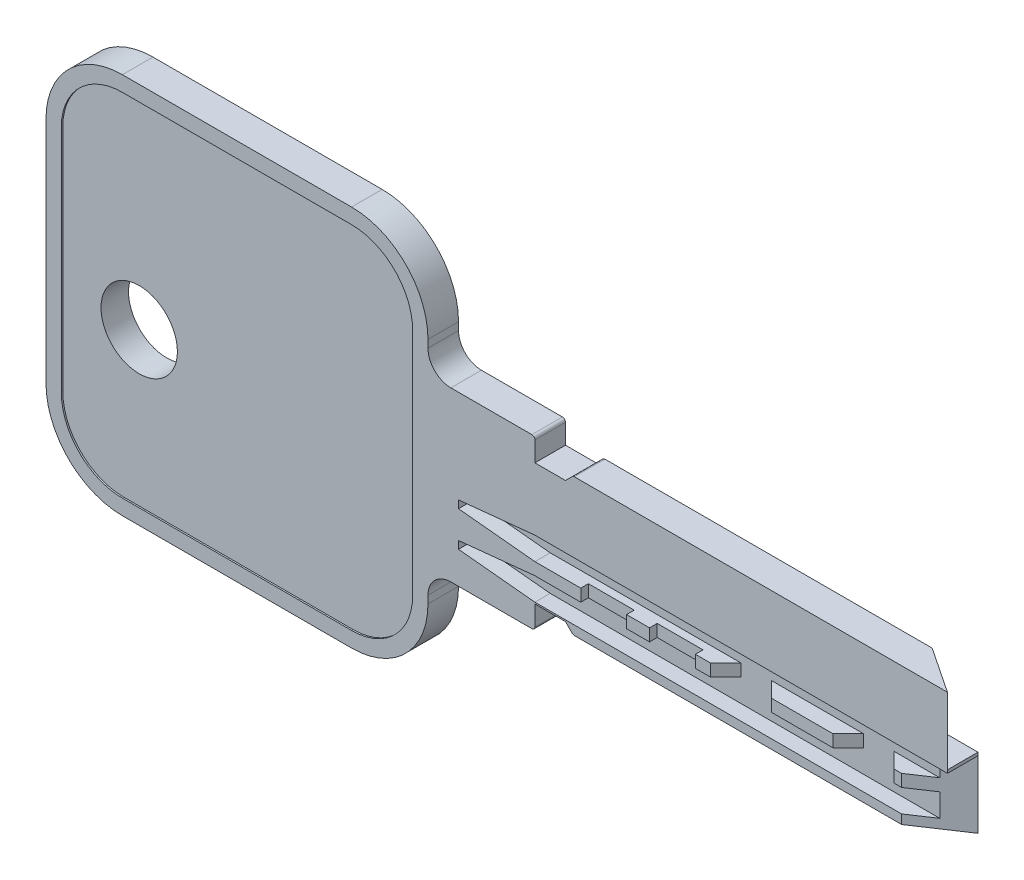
SolidWorks part; units mm, degrees
ref_plane "Front Plane" through (0, 0, 0) normal (0, 0, 1) x (1, 0, 0)
ref_plane "Top Plane" through (0, 0, 0) normal (0, 1, 0) x (1, 0, 0)
ref_plane "Right Plane" through (0, 0, 0) normal (1, 0, 0) x (0, 0, -1)
sketch "Sketch1" plane through (0, 0, 0) normal (0, 0, 1) x (1, 0, 0)
  line L1 (-7.5, 12.5) -> (7.5, 12.5)
  line L2 (-12.5, 7.5) -> (-12.5, -7.5)
  line L3 (-7.5, -12.5) -> (7.5, -12.5)
  line L4 (12.5, 7.5) -> (12.5, -7.5) construction
  line L5 (-12.5, 12.5) -> (12.5, -12.5) construction
  line L6 (-12.5, -12.5) -> (12.5, 12.5) construction
  line L7 (12.5, 0) -> (46.5, 0) construction
  line L8 (12.5, 7.5) -> (12.5, 7)
  line L9 (14, 5.5) -> (46.5, 5.5)
  line L10 (12.5, 5.5) -> (12.5, -5.5) construction
  line L11 (14, -5.5) -> (46.5, -5.5)
  line L12 (46.5, 5.5) -> (46.5, -5.5)
  line L13 (12.5, -7.5) -> (12.5, -7)
  arc A0 (7.5, -12.5) -> (12.5, -7.5) centre (7.5, -7.5) ccw
  arc A1 (-12.5, -7.5) -> (-7.5, -12.5) centre (-7.5, -7.5) ccw
  arc A2 (7.5, 12.5) -> (12.5, 7.5) centre (7.5, 7.5) cw
  arc A3 (-7.5, 12.5) -> (-12.5, 7.5) centre (-7.5, 7.5) ccw
  circle A4 centre (-6.5, -1.5) radius 2.5
  arc A5 (12.5, -7) -> (14, -5.5) centre (14, -7) cw
  arc A6 (14, 5.5) -> (12.5, 7) centre (14, 7) cw
  point P0 (0, 0)
  dimension "D2" = 5
  dimension "D4" = 5
  dimension "D7" = 1.5
  dimension "D1" = 25
  dimension "D3" = 6
  dimension "D5" = 11
  dimension "D6" = 34
  dimension "D8" = 11
extrude "Boss-Extrude1" add sketch "Sketch1" along normal mid plane 2
sketch "Sketch2" plane through (0, 0, 1) normal (0, 0, 1) x (1, 0, 0)
  line L0 (12.5, 7) -> (12.5, 7.5) construction
  line L1 (7.5, 12.5) -> (-7.5, 12.5) construction
  line L2 (-12.5, 7.5) -> (-12.5, -7.5) construction
  line L3 (-7.5, -12.5) -> (7.5, -12.5) construction
  line L4 (12.5, -7.5) -> (12.5, -7) construction
  line L5 (12.5, 7) -> (12.5, 7.5) construction
  line L6 (7.5, 12.5) -> (-7.5, 12.5) construction
  line L7 (-12.5, 7.5) -> (-12.5, -7.5) construction
  line L8 (-7.5, -12.5) -> (7.5, -12.5) construction
  line L9 (12.5, -7.5) -> (12.5, -7) construction
  line L10 (12.5, 7) -> (12.5, -7) construction
  line L11 (11.5, 7) -> (11.5, 7.5)
  line L12 (7.5, 11.5) -> (-7.5, 11.5)
  line L13 (-11.5, 7.5) -> (-11.5, -7.5)
  line L14 (-7.5, -11.5) -> (7.5, -11.5)
  line L15 (11.5, -7.5) -> (11.5, -7)
  line L16 (11.5, 7) -> (11.5, -7)
  arc A0 (12.5, 7.5) -> (7.5, 12.5) centre (7.5, 7.5) ccw construction
  arc A1 (-7.5, 12.5) -> (-12.5, 7.5) centre (-7.5, 7.5) ccw construction
  arc A2 (-12.5, -7.5) -> (-7.5, -12.5) centre (-7.5, -7.5) ccw construction
  arc A3 (7.5, -12.5) -> (12.5, -7.5) centre (7.5, -7.5) ccw construction
  arc A4 (12.5, 7.5) -> (7.5, 12.5) centre (7.5, 7.5) ccw construction
  arc A5 (-7.5, 12.5) -> (-12.5, 7.5) centre (-7.5, 7.5) ccw construction
  arc A6 (-12.5, -7.5) -> (-7.5, -12.5) centre (-7.5, -7.5) ccw construction
  arc A7 (7.5, -12.5) -> (12.5, -7.5) centre (7.5, -7.5) ccw construction
  arc A8 (11.5, 7.5) -> (7.5, 11.5) centre (7.5, 7.5) ccw
  arc A9 (-7.5, 11.5) -> (-11.5, 7.5) centre (-7.5, 7.5) ccw
  arc A10 (-11.5, -7.5) -> (-7.5, -11.5) centre (-7.5, -7.5) ccw
  arc A11 (7.5, -11.5) -> (11.5, -7.5) centre (7.5, -7.5) ccw
  dimension "D1" = 1
extrude "Cut-Extrude2" cut sketch "Sketch2" against normal blind 0.1
mirror "Mirror1" about plane through (0, 0, 0) normal (0, 0, 1) of "Cut-Extrude2"
sketch "Sketch3" plane through (0, 0, 1) normal (0, 0, 1) x (1, 0, 0)
  line L0 (19.5, 5.5) -> (19.5, 4)
  line L1 (46.5, 5.5) -> (14, 5.5) construction
  line L2 (19.5, 4) -> (21.5, 4)
  line L3 (21.5, 4) -> (22, 4.5)
  line L4 (22, 4.5) -> (46.5, 4.5)
  line L5 (46.5, -5.5) -> (46.5, 5.5) construction
  line L6 (46.5, 4.5) -> (46.5, 5.5)
  line L7 (46.5, 5.5) -> (19.5, 5.5)
  line L8 (12.5, 7) -> (12.5, 7.5) construction
  dimension "D1" = 1.5
  dimension "D2" = 7
  dimension "D3" = 1
  dimension "D4" = 2
  dimension "D5" = 2.5
extrude "Cut-Extrude3" cut sketch "Sketch3" along direction (0, 0, 1) on the side against the normal up to next (2 mm away)
fillet "Fillet1" radius 0.2 2 edges at (22, 4.5, 0) (19.5, 5.5, 0)
mirror "Mirror2" about plane through (0, 0, 0) normal (0, 1, 0) of "Cut-Extrude3", "Fillet1"
sketch "Sketch4" plane through (0, 0, 1) normal (0, 0, 1) x (1, 0, 0)
  line L0 (46.5, -0.1) -> (19.5, -0.1)
  line L1 (46.5, -4.5) -> (46.5, 4.5) construction
  line L2 (19.5, -0.1) -> (14.5, -0.6)
  line L3 (14.5, -0.6) -> (14.5, -1.1)
  line L4 (14.5, -1.1) -> (19.5, -1.6)
  line L5 (19.5, -1.6) -> (46.5, -1.6)
  line L6 (46.5, -1.6) -> (46.5, -0.1)
  line L7 (14.5, -0.85) -> (46.5, -0.85) construction
  line L9 (22.0828, -4.5) -> (46.5, -4.5) construction
  dimension "D1" = 5
  dimension "D2" = 1.5
  dimension "D3" = 0.5
  dimension "D4" = 32
  dimension "D5" = 2.9
extrude "Cut-Extrude4" cut sketch "Sketch4" against normal blind 1
pattern_linear "LPattern1" count 2 spacing 2.3 along (0, -1, 0) of "Cut-Extrude4"
sketch "Sketch5" plane through (0, 0, 1) normal (0, 0, 1) x (1, 0, 0)
  line L0 (19.5, -1.6) -> (46.5, -1.6) construction
  line L1 (22.5, -1.6) -> (25.5, -1.6)
  line L2 (22.5, -1.6) -> (22.5, -2.4)
  line L3 (22.5, -2.4) -> (25.5, -2.4)
  line L4 (25.5, -1.6) -> (25.5, -2.4)
  line L5 (46.5, -2.4) -> (19.5, -2.4) construction
  line L6 (19.5, -1.6) -> (46.5, -1.6) construction
  line L7 (27, -1.6) -> (30, -1.6)
  line L8 (27, -1.6) -> (27, -2.4)
  line L9 (27, -2.4) -> (30, -2.4)
  line L10 (30, -1.6) -> (30, -2.4)
  line L11 (46.5, -2.4) -> (19.5, -2.4) construction
  line L12 (12.5, 7) -> (12.5, 7.5) construction
  dimension "D1" = 3
  dimension "D2" = 1.5
  dimension "D3" = 10
extrude "Cut-Extrude5" cut sketch "Sketch5" against normal blind 0.5
sketch "Sketch6" plane through (0, -2.4, 0) normal (0, -1, 0) x (1, 0, 0)
  line L0 (31, 1) -> (32, 0)
  line L1 (22.0828, 1) -> (46.5, 1) construction
  line L2 (32, 0) -> (34, 0)
  line L3 (34, 0) -> (35, 1)
  line L4 (35, 1) -> (31, 1)
  line L5 (39, 1) -> (40, 0)
  line L6 (40, 0) -> (42, 0)
  line L7 (42, 0) -> (43, 1)
  line L8 (43, 1) -> (39, 1)
  line L9 (33, 0) -> (33, 1) construction
  line L10 (41, 0) -> (41, 1) construction
  line L11 (46.5, -1) -> (46.5, 1) construction
  dimension "D1" = 4
  dimension "D2" = 2
  dimension "D3" = 4
  dimension "D4" = 3.5
extrude "Cut-Extrude6" cut sketch "Sketch6" against normal up to surface (0.8 mm away) contours L3 L0 M15 M17 | L7 L5 M15 M17
sketch "Sketch7" plane through (0, -4.5, 0) normal (0, -1, 0) x (1, 0, 0)
  line L0 (46.5, -1) -> (43.5, 1)
  line L1 (22.0828, 1) -> (46.5, 1) construction
  line L2 (43.5, 1) -> (46.5, 1)
  line L3 (46.5, 1) -> (46.5, -1)
  dimension "D1" = 3
extrude "Cut-Extrude7" cut sketch "Sketch7" against normal up to surface (4.4 mm away)
sketch "Sketch8" plane through (0, 0, -1) normal (0, 0, -1) x (-1, 0, 0)
  line L0 (-46.5, 0.1) -> (-19.5, 0.1)
  line L1 (-46.5, -4.5) -> (-46.5, -0.1) construction
  line L2 (-19.5, 0.1) -> (-14.5, 0.6)
  line L3 (-14.5, 0.6) -> (-14.5, 1.1)
  line L4 (-14.5, 1.1) -> (-19.5, 1.6)
  line L5 (-19.5, 1.6) -> (-46.5, 1.6)
  line L6 (-46.5, -0.1) -> (-46.5, 4.5) construction
  line L7 (-46.5, 1.6) -> (-46.5, 0.1)
  line L8 (-46.5, 0.85) -> (-14.5, 0.85) construction
  line L9 (-46.5, 4.5) -> (-22.0828, 4.5) construction
  dimension "D1" = 32
  dimension "D2" = 0.5
  dimension "D3" = 1.5
  dimension "D4" = 5
  dimension "D5" = 2.9
extrude "Cut-Extrude8" cut sketch "Sketch8" against normal blind 1
pattern_linear "LPattern2" count 2 spacing 2.3 along (0, 1, 0) of "Cut-Extrude8"
sketch "Sketch9" plane through (0, 0, -1) normal (0, 0, -1) x (-1, 0, 0)
  line L0 (-46.5, 2.4) -> (-19.5, 2.4) construction
  line L1 (-21.5, 2.4) -> (-24.5, 2.4)
  line L2 (-21.5, 2.4) -> (-21.5, 1.6)
  line L3 (-21.5, 1.6) -> (-24.5, 1.6)
  line L4 (-24.5, 2.4) -> (-24.5, 1.6)
  line L5 (-19.5, 1.6) -> (-46.5, 1.6) construction
  line L6 (-46.5, 2.4) -> (-19.5, 2.4) construction
  line L7 (-26, 2.4) -> (-29, 2.4)
  line L8 (-26, 2.4) -> (-26, 1.6)
  line L9 (-26, 1.6) -> (-29, 1.6)
  line L10 (-29, 2.4) -> (-29, 1.6)
  line L11 (-19.5, 1.6) -> (-46.5, 1.6) construction
  line L12 (-11.5, -7.5) -> (-11.5, 7.5) construction
  dimension "D1" = 3
  dimension "D2" = 10
  dimension "D3" = 1.5
extrude "Cut-Extrude9" cut sketch "Sketch9" against normal blind 0.5
sketch "Sketch10" plane through (0, 2.4, 0) normal (0, 1, 0) x (1, 0, 0)
  line L0 (31, 1) -> (32, 0)
  line L1 (46.5, 1) -> (22.0828, 1) construction
  line L2 (32, 0) -> (34, 0)
  line L3 (34, 0) -> (35, 1)
  line L4 (35, 1) -> (31, 1)
  line L5 (39, 1) -> (40, 0)
  line L6 (40, 0) -> (42, 0)
  line L7 (42, 0) -> (43, 1)
  line L8 (43, 1) -> (39, 1)
  line L9 (33, 0) -> (33, 1) construction
  line L10 (41, 0) -> (41, 1) construction
  line L11 (46.5, 1) -> (46.5, -1) construction
  dimension "D1" = 4
  dimension "D2" = 2
  dimension "D3" = 4
  dimension "D4" = 3.5
extrude "Cut-Extrude10" cut sketch "Sketch10" against normal up to surface (0.8 mm away)
sketch "Sketch11" plane through (0, 4.5, 0) normal (0, 1, 0) x (1, 0, 0)
  line L0 (46.5, -1) -> (43.5, 1)
  line L1 (46.5, 1) -> (22.0828, 1) construction
  line L2 (43.5, 1) -> (46.5, 1)
  line L3 (46.5, 1) -> (46.5, -1)
  dimension "D1" = 3
extrude "Cut-Extrude11" cut sketch "Sketch11" against normal up to surface (4.4 mm away)
